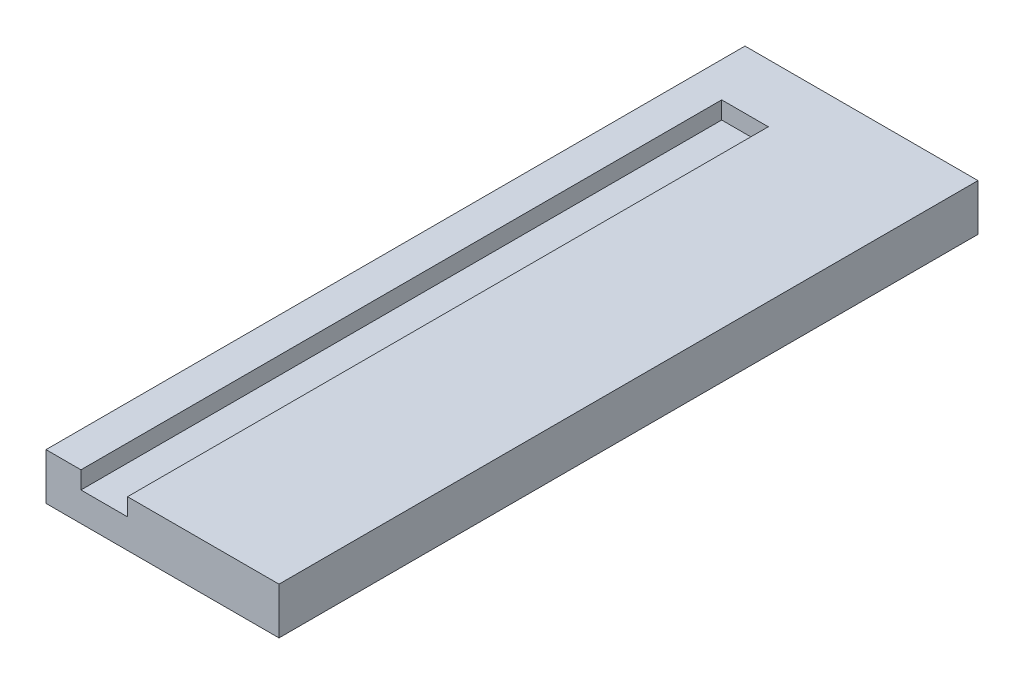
SolidWorks part; units mm, degrees
ref_plane "Front Plane" through (0, 0, 0) normal (0, 0, 1) x (1, 0, 0)
ref_plane "Top Plane" through (0, 0, 0) normal (0, 1, 0) x (1, 0, 0)
ref_plane "Right Plane" through (0, 0, 0) normal (1, 0, 0) x (0, 0, -1)
sketch "Sketch1" plane through (0, 0, 0) normal (0, 0, 1) x (1, 0, 0)
  line L1 (0, 0) -> (200, 0)
  line L2 (0, 0) -> (0, -40)
  line L3 (0, -40) -> (200, -40)
  line L4 (200, 0) -> (200, -40)
  dimension "D1" = 200
  dimension "D2" = 40
extrude "Boss-Extrude1" add sketch "Sketch1" against normal blind 600
sketch "Sketch2" plane through (0, 0, 0) normal (0, 0, 1) x (1, 0, 0)
  line L1 (200, 0) -> (0, 0) construction
  line L2 (30, 0) -> (70, 0)
  line L3 (70, 0) -> (70, -15)
  line L4 (70, -15) -> (30, -15)
  line L5 (30, -15) -> (30, 0)
  dimension "D2" = 40
  dimension "D3" = 15
extrude "Cut-Extrude1" cut sketch "Sketch2" against normal blind 550
